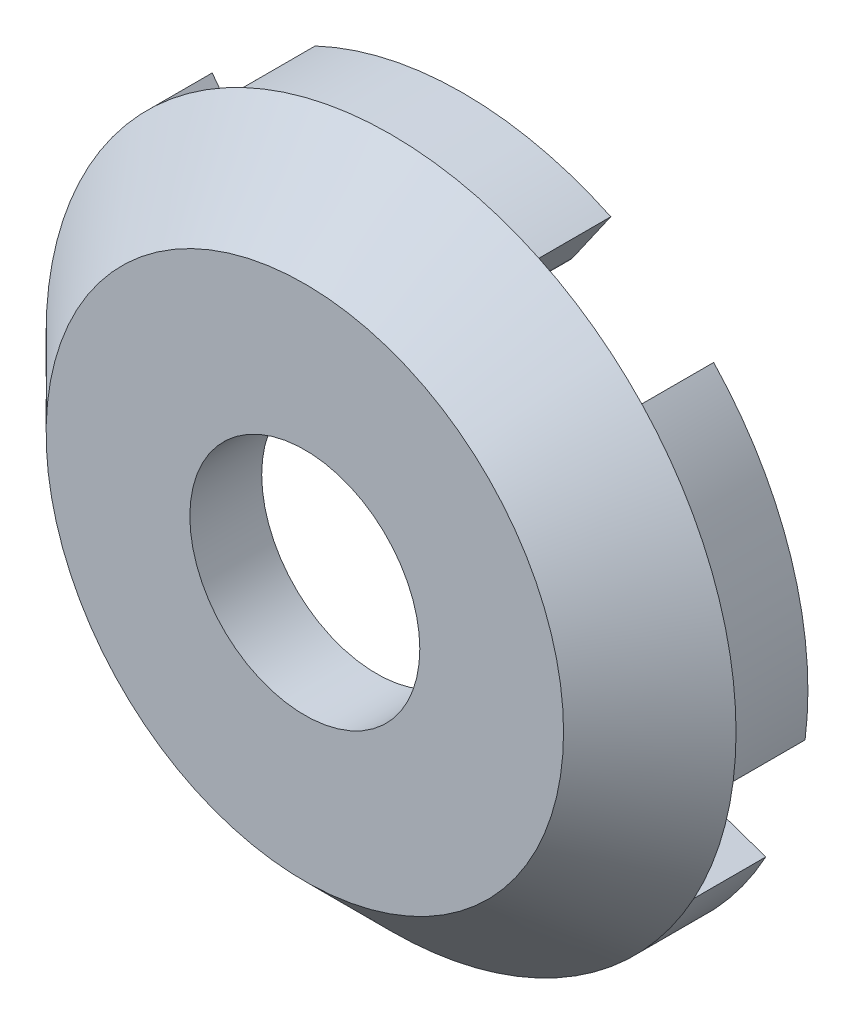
SolidWorks part; units mm, degrees
ref_plane "前视基准面" through (0, 0, 0) normal (0, 0, 1) x (1, 0, 0)
ref_plane "上视基准面" through (0, 0, 0) normal (0, 1, 0) x (1, 0, 0)
ref_plane "右视基准面" through (0, 0, 0) normal (1, 0, 0) x (0, 0, -1)
sketch "草图1" plane through (0, 0, 0) normal (0, 0, 1) x (1, 0, 0)
  line L0 (-20.0965, 0) -> (19.1891, 0) construction
  line L1 (0, 17.7212) -> (0, 6.4618) construction
  line L2 (-3.28, 8.1724) -> (-5.1433, 10.8419)
  line L3 (5.1433, 10.8419) -> (3.28, 8.1724)
  line L4 (0, 0) -> (0, -12) construction
  line L5 (6.7588, 5.6449) -> (8.7219, 8.2419)
  line L6 (8.786, -0.5941) -> (11.9006, -1.5413)
  line L7 (7.4572, -4.6836) -> (10.5337, -5.7481)
  line L8 (2.15, -8.5395) -> (2.2117, -11.7944)
  line L9 (-2.15, -8.5395) -> (-2.2117, -11.7944)
  line L10 (-7.4572, -4.6836) -> (-10.5337, -5.7481)
  line L11 (-8.786, -0.5941) -> (-11.9006, -1.5413)
  line L12 (-6.7588, 5.6449) -> (-8.7219, 8.2419)
  arc A0 (-3.28, 8.1724) -> (3.28, 8.1724) centre (0, 10.4618) ccw
  arc A1 (11.9006, -1.5413) -> (8.7219, 8.2419) centre (0, 0) ccw
  arc A2 (2.2117, -11.7944) -> (10.5337, -5.7481) centre (0, 0) ccw
  arc A3 (6.7588, 5.6449) -> (8.786, -0.5941) centre (9.9497, 3.2329) ccw
  arc A4 (-10.5337, -5.7481) -> (-2.2117, -11.7944) centre (0, 0) ccw
  arc A5 (7.4572, -4.6836) -> (2.15, -8.5395) centre (6.1493, -8.4638) ccw
  arc A6 (-8.7219, 8.2419) -> (-11.9006, -1.5413) centre (0, 0) ccw
  arc A7 (-2.15, -8.5395) -> (-7.4572, -4.6836) centre (-6.1493, -8.4638) ccw
  arc A9 (-8.786, -0.5941) -> (-6.7588, 5.6449) centre (-9.9497, 3.2329) ccw
  arc A12 (5.1433, 10.8419) -> (-5.1433, 10.8419) centre (0, 0) ccw
  point P33 (0, 0)
  dimension "D2" = 24
extrude "凸台-拉伸1" add sketch "草图1" along normal blind 2.5
sketch "草图2" plane through (0, 0, 2.5) normal (0, 0, 1) x (1, 0, 0)
  circle A0 centre (0, 0) radius 12
  circle A1 centre (0, 0) radius 4
  dimension "D1" = 8
extrude "凸台-拉伸2" add sketch "草图2" along normal blind 3
chamfer "倒角1" distance 3 angle 45 1 edges at (12, 0, 5.5)
sketch "草图4" plane through (0, 0, 0) normal (0, 0, -1) x (-1, 0, 0)
  circle A0 centre (0, 0) radius 9
  dimension "D1" = 18
extrude "切除-拉伸1" cut sketch "草图4" against normal blind 3
fillet "圆角1" radius 1 10 edges at (3.3939, 8.3355, 1.25) (-3.3939, 8.3355, 1.25) (-8.9764, -0.652, 1.25) (-6.8788, 5.8036, 1.25) (-7.6453, -4.7487, 1.25) (-2.1538, -8.7385, 1.25) (6.8788, 5.8036, 1.25) (8.9764, -0.652, 1.25) (7.6453, -4.7487, 1.25) (2.1538, -8.7385, 1.25)
